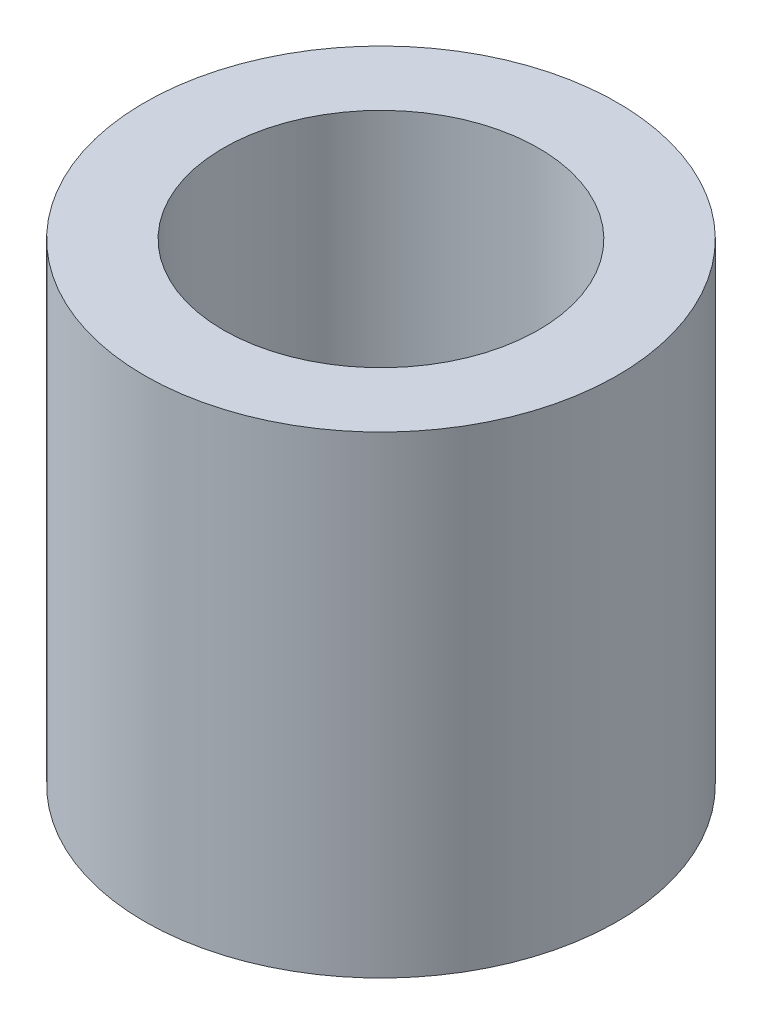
SolidWorks part; units mm, degrees
ref_plane "Front Plane" through (0, 0, 0) normal (0, 0, 1) x (1, 0, 0)
ref_plane "Top Plane" through (0, 0, 0) normal (0, 1, 0) x (1, 0, 0)
ref_plane "Right Plane" through (0, 0, 0) normal (1, 0, 0) x (0, 0, -1)
sketch "Sketch1" plane through (0, 0, 0) normal (0, 1, 0) x (1, 0, 0)
  circle A0 centre (0, 0) radius 1.5
  circle A1 centre (0, 0) radius 1
  dimension "D1" = 2
  dimension "D2" = 3
extrude "Boss-Extrude1" add sketch "Sketch1" along normal blind 3
sketch "Sketch2" plane through (0, 0, 0) normal (0, -1, 0) x (1, 0, 0)
  line L0 (0, 0) -> (1, 0) construction
  circle A0 centre (0, 0) radius 1 construction
